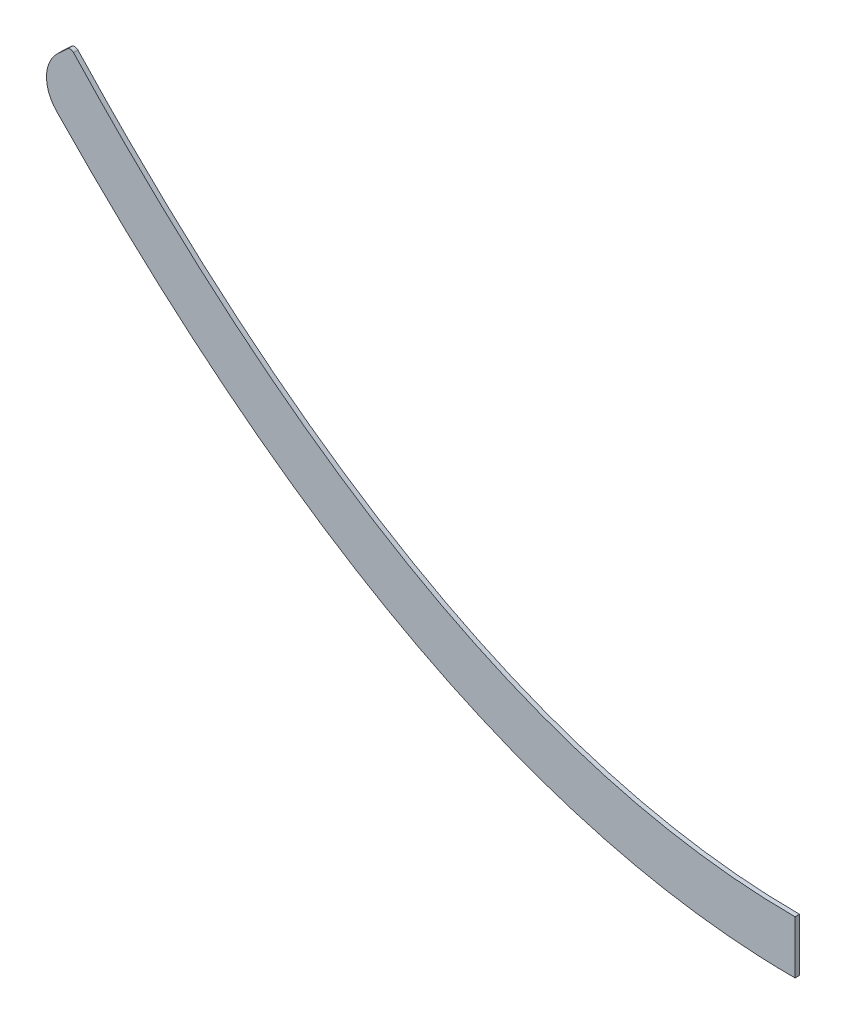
SolidWorks part; units mm, degrees
ref_plane "Front Plane" through (0, 0, 0) normal (0, 0, 1) x (1, 0, 0)
ref_plane "Top Plane" through (0, 0, 0) normal (0, 1, 0) x (1, 0, 0)
ref_plane "Right Plane" through (0, 0, 0) normal (1, 0, 0) x (0, 0, -1)
sketch "Sketch1" plane through (0, 0, 0) normal (0, 0, 1) x (1, 0, 0)
  line L0 (0, 0) -> (1092.2, 0) construction
  line L1 (1092.2, 0) -> (1092.2, -101.6) construction
  line L2 (1092.2, -101.6) -> (1092.2, -584.2) construction
  line L3 (50.8, -22.3921) -> (1092.2, -22.3921) construction
  line L4 (1092.2, -584.2) -> (1092.2, -660.4)
  line L5 (50.8, -22.3921) -> (-5.0874, -74.1902)
  parabola Q0
  spline S0 degree 1 poles (-5.0874, -74.1902) (1092.2, -660.4) knots 0 0 1 1 construction
  spline S1 degree 3 poles (-5.0874, -74.1902) (-2.3136, -77.183) (3.2536, -83.1662) (14.3718, -95.0216) (28.2828, -109.6791) (44.9838, -126.9948) (67.2675, -149.7229) (95.15, -177.4567) (128.6567, -209.6549) (162.2132, -240.7696) (207.0249, -280.8096) (263.1765, -328.1446) (330.7973, -380.5882) (398.6759, -428.6548) (466.8295, -472.3205) (558.0852, -524.634) (672.9001, -578.8648) (811.8464, -625.7505) (928.4295, -649.3573) (1021.9784, -658.821) (1068.7819, -660.4) (1092.2, -660.4) knots 0.488149 0.488149 0.488149 0.488149 0.488241 0.488334 0.488519 0.488704 0.488889 0.48926 0.48963 0.490001 0.490371 0.491112 0.491852 0.492593 0.493334 0.494074 0.495556 0.497037 0.498519 0.499259 0.5 0.5 0.5 0.5
  dimension "D1" = 1092.2
  dimension "D2" = 101.6
  dimension "D3" = 482.6
  dimension "D4" = 1041.4
  dimension "D5" = 76.2
extrude "Boss-Extrude1" add sketch "Sketch1" along normal blind 6.35
fillet "Fillet1" radius 6.35 1 edges at (50.8, -22.3921, 3.175)
fillet "Fillet2" radius 50.8 1 edges at (-5.0874, -74.1902, 3.175)
